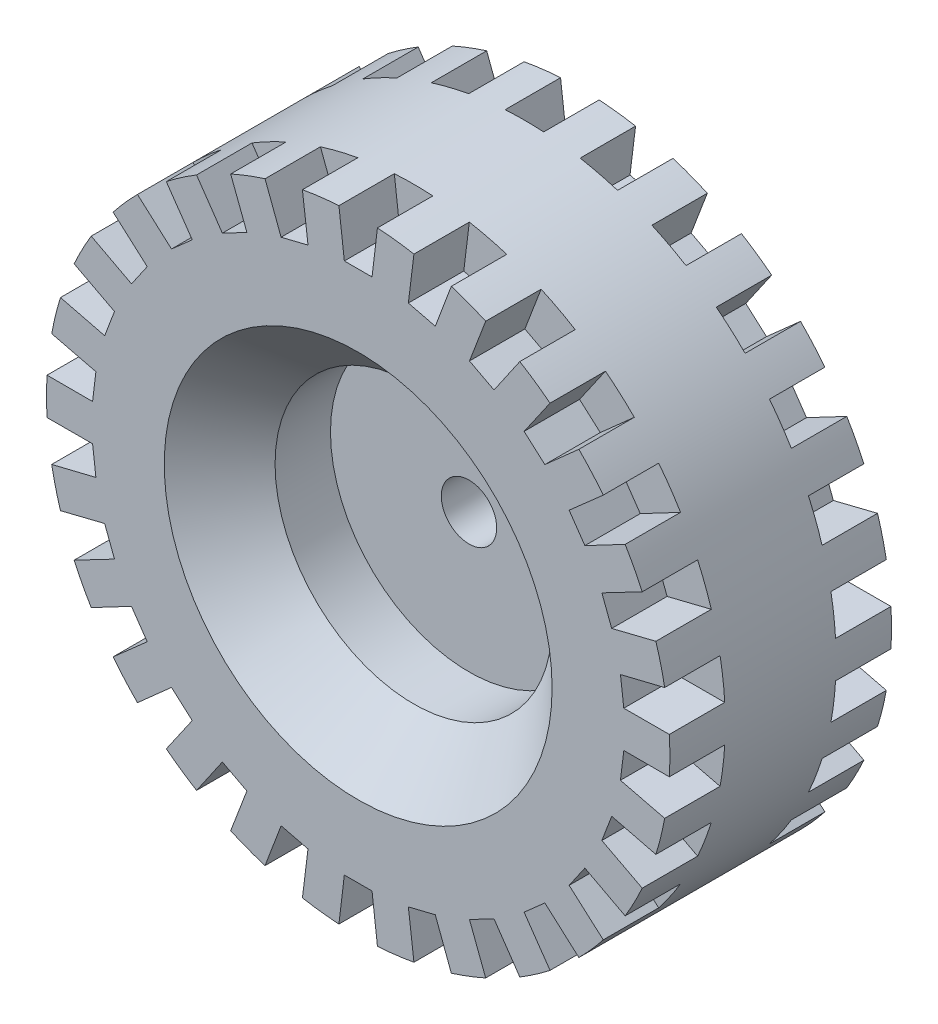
SolidWorks part; units mm, degrees
ref_plane "Front Plane" through (0, 0, 0) normal (0, 0, 1) x (1, 0, 0)
ref_plane "Top Plane" through (0, 0, 0) normal (0, 1, 0) x (1, 0, 0)
ref_plane "Right Plane" through (0, 0, 0) normal (1, 0, 0) x (0, 0, -1)
sketch "Sketch1" plane through (0, 0, 0) normal (0, 0, 1) x (1, 0, 0)
  circle A0 centre (0, 0) radius 2
  circle A1 centre (0, 0) radius 22.5
  dimension "D1" = 4
  dimension "D2" = 45
extrude "Extrude1" add sketch "Sketch1" along normal mid plane 16
sketch "Sketch2" plane through (0, 0, 8) normal (0, 0, 1) x (1, 0, 0)
  circle A0 centre (0, 0) radius 10
  dimension "D1" = 20
extrude "Extrude2" cut sketch "Sketch2" against normal blind 8
chamfer "Chamfer1" distance 4 angle 45 1 edges at (10, 0, 8)
sketch "Sketch3" plane through (0, 0, 8) normal (0, 0, 1) x (1, 0, 0)
  line L0 (0, 0) -> (0, 24.3402) construction
  line L1 (-1, 19.1937) -> (1, 19.1937)
  line L2 (1, 19.1937) -> (1.5, 23.3715)
  line L3 (1.5, 23.3715) -> (-1.5, 23.3715)
  line L4 (-1, 19.1937) -> (-1.5, 23.3715)
  line L5 (7.0496, 22.3334) -> (4.1367, 23.0513)
  line L6 (3.6224, 18.8752) -> (4.1367, 23.0513)
  line L7 (5.5643, 18.3966) -> (7.0496, 22.3334)
  line L8 (3.6224, 18.8752) -> (5.5643, 18.3966)
  line L9 (12.1894, 19.9973) -> (9.5331, 21.3915)
  line L10 (8.0343, 17.4599) -> (9.5331, 21.3915)
  line L11 (9.8052, 16.5304) -> (12.1894, 19.9973)
  line L12 (8.0343, 17.4599) -> (9.8052, 16.5304)
  line L13 (16.6209, 16.4991) -> (14.3754, 18.4885)
  line L14 (11.9792, 15.0298) -> (14.3754, 18.4885)
  line L15 (13.4763, 13.7035) -> (16.6209, 16.4991)
  line L16 (11.9792, 15.0298) -> (13.4763, 13.7035)
  line L17 (20.0864, 12.042) -> (18.3822, 14.511)
  line L18 (15.228, 11.7262) -> (18.3822, 14.511)
  line L19 (16.3641, 10.0803) -> (20.0864, 12.042)
  line L20 (15.228, 11.7262) -> (16.3641, 10.0803)
  line L21 (22.3846, 6.8851) -> (21.3208, 9.6902)
  line L22 (17.5918, 7.7412) -> (21.3208, 9.6902)
  line L23 (18.301, 5.8711) -> (22.3846, 6.8851)
  line L24 (17.5918, 7.7412) -> (18.301, 5.8711)
  line L25 (23.3819, 1.3281) -> (23.0202, 4.3062)
  line L26 (18.9332, 3.3062) -> (23.0202, 4.3062)
  line L27 (19.1743, 1.3208) -> (23.3819, 1.3281)
  line L28 (18.9332, 3.3062) -> (19.1743, 1.3208)
  line L29 (23.0202, -4.3062) -> (23.3819, -1.3281)
  line L30 (19.1743, -1.3208) -> (23.3819, -1.3281)
  line L31 (18.9332, -3.3062) -> (23.0202, -4.3062)
  line L32 (19.1743, -1.3208) -> (18.9332, -3.3062)
  line L33 (21.3208, -9.6902) -> (22.3846, -6.8851)
  line L34 (18.301, -5.8711) -> (22.3846, -6.8851)
  line L35 (17.5918, -7.7412) -> (21.3208, -9.6902)
  line L36 (18.301, -5.8711) -> (17.5918, -7.7412)
  line L37 (18.3822, -14.511) -> (20.0864, -12.042)
  line L38 (16.3641, -10.0803) -> (20.0864, -12.042)
  line L39 (15.228, -11.7262) -> (18.3822, -14.511)
  line L40 (16.3641, -10.0803) -> (15.228, -11.7262)
  line L41 (14.3754, -18.4885) -> (16.6209, -16.4991)
  line L42 (13.4763, -13.7035) -> (16.6209, -16.4991)
  line L43 (11.9792, -15.0298) -> (14.3754, -18.4885)
  line L44 (13.4763, -13.7035) -> (11.9792, -15.0298)
  line L45 (9.5331, -21.3915) -> (12.1894, -19.9973)
  line L46 (9.8052, -16.5304) -> (12.1894, -19.9973)
  line L47 (8.0343, -17.4599) -> (9.5331, -21.3915)
  line L48 (9.8052, -16.5304) -> (8.0343, -17.4599)
  line L49 (4.1367, -23.0513) -> (7.0496, -22.3334)
  line L50 (5.5643, -18.3966) -> (7.0496, -22.3334)
  line L51 (3.6224, -18.8752) -> (4.1367, -23.0513)
  line L52 (5.5643, -18.3966) -> (3.6224, -18.8752)
  line L53 (-1.5, -23.3715) -> (1.5, -23.3715)
  line L54 (1, -19.1937) -> (1.5, -23.3715)
  line L55 (-1, -19.1937) -> (-1.5, -23.3715)
  line L56 (1, -19.1937) -> (-1, -19.1937)
  line L57 (-7.0496, -22.3334) -> (-4.1367, -23.0513)
  line L58 (-3.6224, -18.8752) -> (-4.1367, -23.0513)
  line L59 (-5.5643, -18.3966) -> (-7.0496, -22.3334)
  line L60 (-3.6224, -18.8752) -> (-5.5643, -18.3966)
  line L61 (-12.1894, -19.9973) -> (-9.5331, -21.3915)
  line L62 (-8.0343, -17.4599) -> (-9.5331, -21.3915)
  line L63 (-9.8052, -16.5304) -> (-12.1894, -19.9973)
  line L64 (-8.0343, -17.4599) -> (-9.8052, -16.5304)
  line L65 (-16.6209, -16.4991) -> (-14.3754, -18.4885)
  line L66 (-11.9792, -15.0298) -> (-14.3754, -18.4885)
  line L67 (-13.4763, -13.7035) -> (-16.6209, -16.4991)
  line L68 (-11.9792, -15.0298) -> (-13.4763, -13.7035)
  line L69 (-20.0864, -12.042) -> (-18.3822, -14.511)
  line L70 (-15.228, -11.7262) -> (-18.3822, -14.511)
  line L71 (-16.3641, -10.0803) -> (-20.0864, -12.042)
  line L72 (-15.228, -11.7262) -> (-16.3641, -10.0803)
  line L73 (-22.3846, -6.8851) -> (-21.3208, -9.6902)
  line L74 (-17.5918, -7.7412) -> (-21.3208, -9.6902)
  line L75 (-18.301, -5.8711) -> (-22.3846, -6.8851)
  line L76 (-17.5918, -7.7412) -> (-18.301, -5.8711)
  line L77 (-23.3819, -1.3281) -> (-23.0202, -4.3062)
  line L78 (-18.9332, -3.3062) -> (-23.0202, -4.3062)
  line L79 (-19.1743, -1.3208) -> (-23.3819, -1.3281)
  line L80 (-18.9332, -3.3062) -> (-19.1743, -1.3208)
  line L81 (-23.0202, 4.3062) -> (-23.3819, 1.3281)
  line L82 (-19.1743, 1.3208) -> (-23.3819, 1.3281)
  line L83 (-18.9332, 3.3062) -> (-23.0202, 4.3062)
  line L84 (-19.1743, 1.3208) -> (-18.9332, 3.3062)
  line L85 (-21.3208, 9.6902) -> (-22.3846, 6.8851)
  line L86 (-18.301, 5.8711) -> (-22.3846, 6.8851)
  line L87 (-17.5918, 7.7412) -> (-21.3208, 9.6902)
  line L88 (-18.301, 5.8711) -> (-17.5918, 7.7412)
  line L89 (-18.3822, 14.511) -> (-20.0864, 12.042)
  line L90 (-16.3641, 10.0803) -> (-20.0864, 12.042)
  line L91 (-15.228, 11.7262) -> (-18.3822, 14.511)
  line L92 (-16.3641, 10.0803) -> (-15.228, 11.7262)
  line L93 (-14.3754, 18.4885) -> (-16.6209, 16.4991)
  line L94 (-13.4763, 13.7035) -> (-16.6209, 16.4991)
  line L95 (-11.9792, 15.0298) -> (-14.3754, 18.4885)
  line L96 (-13.4763, 13.7035) -> (-11.9792, 15.0298)
  line L97 (-9.5331, 21.3915) -> (-12.1894, 19.9973)
  line L98 (-9.8052, 16.5304) -> (-12.1894, 19.9973)
  line L99 (-8.0343, 17.4599) -> (-9.5331, 21.3915)
  line L100 (-9.8052, 16.5304) -> (-8.0343, 17.4599)
  line L101 (-4.1367, 23.0513) -> (-7.0496, 22.3334)
  line L102 (-5.5643, 18.3966) -> (-7.0496, 22.3334)
  line L103 (-3.6224, 18.8752) -> (-4.1367, 23.0513)
  line L104 (-5.5643, 18.3966) -> (-3.6224, 18.8752)
  point P9 (0, 19.1937)
  point P10 (0, 23.3715)
  dimension "D1" = 1
  dimension "D2" = 1.5
extrude "Extrude3" cut sketch "Sketch3" against normal blind 4
mirror "Mirror1" about plane through (0, 0, 0) normal (0, 0, 1) of "Extrude3"
